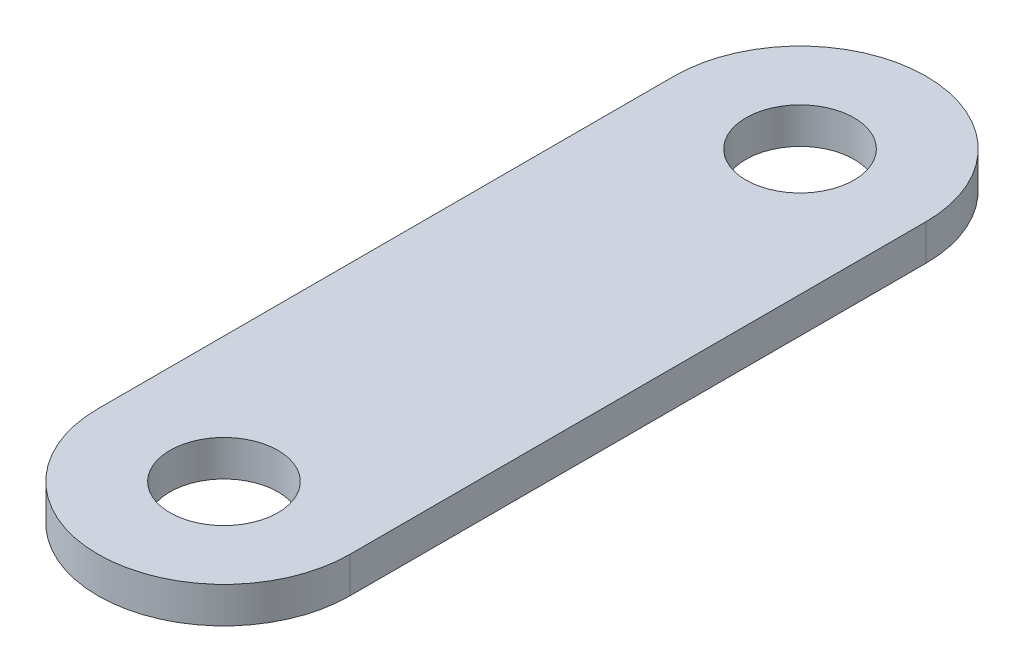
SolidWorks part; units mm, degrees
ref_plane "Front" through (0, 0, 0) normal (0, 0, 1) x (1, 0, 0)
ref_plane "Top" through (0, 0, 0) normal (0, 1, 0) x (1, 0, 0)
ref_plane "Right" through (0, 0, 0) normal (1, 0, 0) x (0, 0, -1)
sketch "Sketch1" plane through (0, 0, 0) normal (0, 1, 0) x (1, 0, 0)
  line L0 (0, 9.5) -> (-7.5377, 9.5) construction
  line L1 (-3.5, 8) -> (3.5, 8) construction
  line L2 (-3.5, 8) -> (-3.5, 0)
  line L3 (-3.5, 0) -> (3.5, 0)
  line L4 (3.5, 8) -> (3.5, 0)
  line L5 (0, 11.5) -> (-7.5377, 11.5) construction
  circle A0 centre (0, 8) radius 1.5
  arc A1 (-3.5, 8) -> (3.5, 8) centre (0, 8) cw
  point P4 (0, 0)
  dimension "D1" = 3
  dimension "D2" = 2
  dimension "D3" = 8
extrude "Boss-Extrude1" add sketch "Sketch1" along normal blind 1
mirror "Mirror1" about plane through (-3.5, 1, 0) normal (0, 0, -1)
